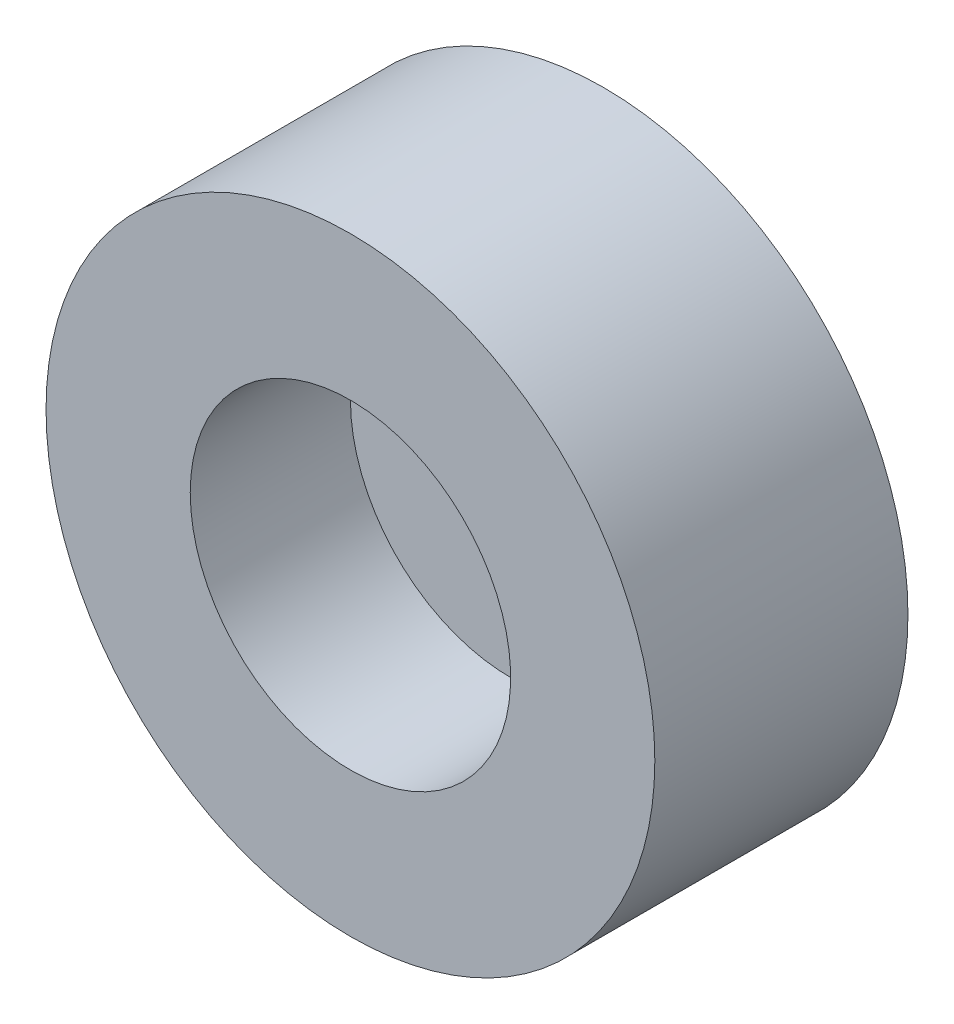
SolidWorks part; units mm, degrees
ref_plane "Face" through (0, 0, 0) normal (0, 0, 1) x (1, 0, 0)
ref_plane "Dessus" through (0, 0, 0) normal (0, 1, 0) x (1, 0, 0)
ref_plane "Droite" through (0, 0, 0) normal (1, 0, 0) x (0, 0, -1)
sketch "Esquisse1" plane through (0, 0, 0) normal (0, 0, 1) x (1, 0, 0)
  circle A0 centre (0, 11) radius 9.5
  arc A1 (9.0624, 8.15) -> (9.0624, 13.85) centre (0, 11) ccw construction
  circle A2 centre (0, 11) radius 5 construction
  circle A3 centre (0, 11) radius 5
extrude "Boss.-Extru.1" add sketch "Esquisse1" along normal up to surface (7.9 mm away)
sketch "Esquisse2" plane through (0, 0, 0) normal (0, 0, -1) x (-1, 0, 0)
  circle A0 centre (0, 11) radius 5 construction
  circle A1 centre (0, 11) radius 5
extrude "Boss.-Extru.2" add sketch "Esquisse2" against normal up to surface (2.9 mm away)
